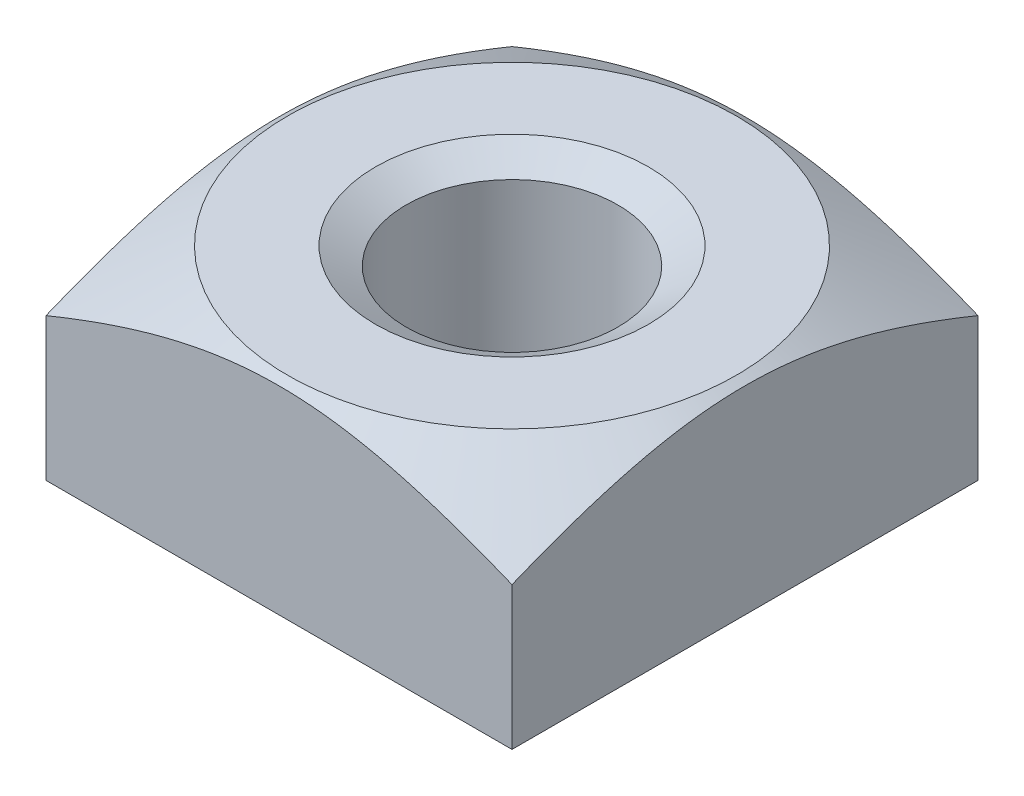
SolidWorks part; units mm, degrees
ref_plane "Front Plane" through (0, 0, 0) normal (0, 0, 1) x (1, 0, 0)
ref_plane "Top Plane" through (0, 0, 0) normal (0, 1, 0) x (1, 0, 0)
ref_plane "Right Plane" through (0, 0, 0) normal (1, 0, 0) x (0, 0, -1)
other "Configuration Table"
sketch "BaseNutSke" plane through (0, 0, 0) normal (0, 1, 0) x (1, 0, 0)
  line L0 (-54.4776, 0) -> (74.7044, 0) construction
  line L1 (0, 52.5898) -> (0, -71.4681) construction
  line L3 (-2.75, 2.75) -> (2.75, 2.75)
  line L4 (-2.75, 2.75) -> (-2.75, -2.75)
  line L5 (-2.75, -2.75) -> (2.75, -2.75)
  line L6 (2.75, 2.75) -> (2.75, -2.75)
  dimension "Width" = 5.5
extrude "Basenut" add sketch "BaseNutSke" along normal blind 2.4
sketch "CutNutSke" plane through (0, 0, 0) normal (0, 0, 1) x (1, 0, 0)
  line L0 (2.65, 2.4) -> (6.8069, 2.4)
  line L1 (6.8069, 2.4) -> (6.8069, 0)
  line L2 (6.8069, 0) -> (2.65, 2.4)
  line L3 (0, 0) -> (0, 5.607) construction
  line L4 (-2.75, 2.4) -> (2.75, 2.4) construction
  dimension "D1" = 30
  dimension "FaceDiameter" = 5.3
revolve "CutNut" cut sketch "CutNutSke" angle 360 about L3
sketch "HoleSke" plane through (0, 0, 0) normal (0, 1, 0) x (1, 0, 0)
  circle A0 centre (0, 0) radius 1.25
extrude "TappedHole" cut sketch "HoleSke" along normal through all
chamfer "Chamfer1" distance 0.2083 angle 60 2 edges at (0, 0, 1.25) (0, 2.4, 1.25)
sketch "ThdSchSke" plane through (0, 0, 0) normal (0, 0, 1) x (1, 0, 0)
  line L0 (1.5, 2.0473) -> (1.25, 2.1917)
  line L1 (1.25, 2.1917) -> (0.9613, 2.1917)
  line L2 (0.9613, 2.1917) -> (0.9613, 1.903)
  line L3 (0.9613, 1.903) -> (1.25, 1.903)
  line L4 (1.25, 1.903) -> (1.5, 2.0473)
  line L6 (1.25, 2.1917) -> (-1.25, 2.1917) construction
  line L7 (0, 0) -> (0, 3.2439) construction
revolve "ThreadSchematic" [suppressed] cut sketch "ThdSchSke" angle 360 about L7
pattern_linear "ThdSchPat" [suppressed] count 4 along (0, 1, 0)
equation "\"D1@Chamfer1\" = \"Tap_drill@HoleSke\"/12"
equation "\"D1@ThdSchSke\" = \"Thread_major@ThreadCosmetic\""
equation "\"D2@ThdSchSke\" = \"Tap_drill@HoleSke\""
equation "\"D1@ThdSchPat\" =  int(( \"Height@Basenut\" -\"D1@Chamfer1\"*2)/ \"ADVANCE@ThdSchPat\" ) +1"
